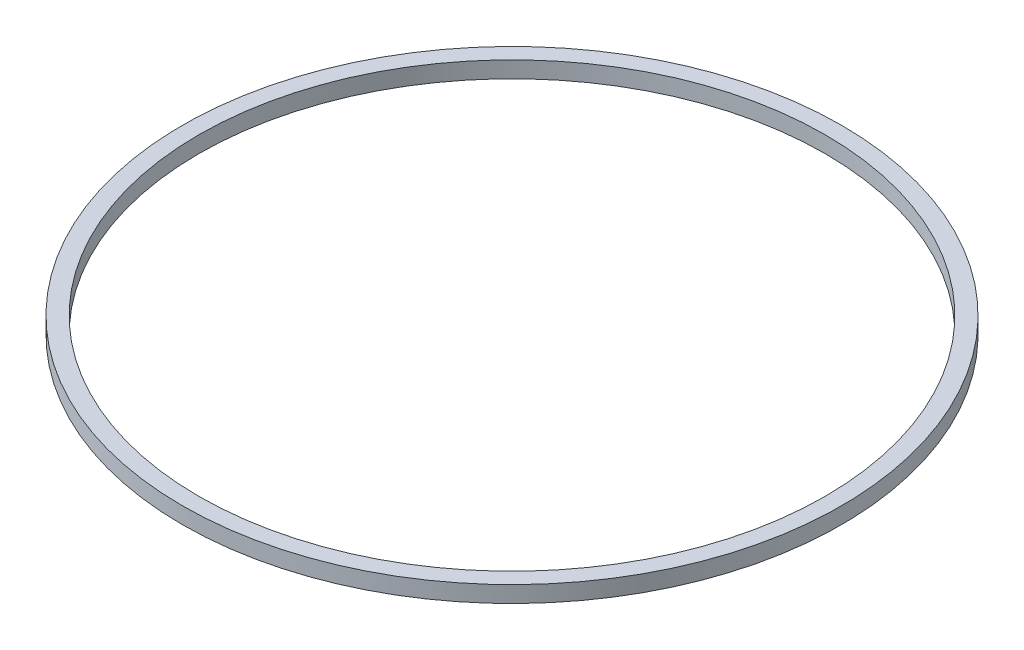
SolidWorks part; units mm, degrees
ref_plane "Front Plane" through (0, 0, 0) normal (0, 0, 1) x (1, 0, 0)
ref_plane "Top Plane" through (0, 0, 0) normal (0, 1, 0) x (1, 0, 0)
ref_plane "Right Plane" through (0, 0, 0) normal (1, 0, 0) x (0, 0, -1)
sketch "Sketch1" plane through (0, 0, 0) normal (0, 1, 0) x (1, 0, 0)
  circle A0 centre (0, 0) radius 80.4
  circle A1 centre (0, 0) radius 76.4
  dimension "D1" = 152.8
  dimension "D2" = 4
extrude "Boss-Extrude1" add sketch "Sketch1" along normal blind 4
